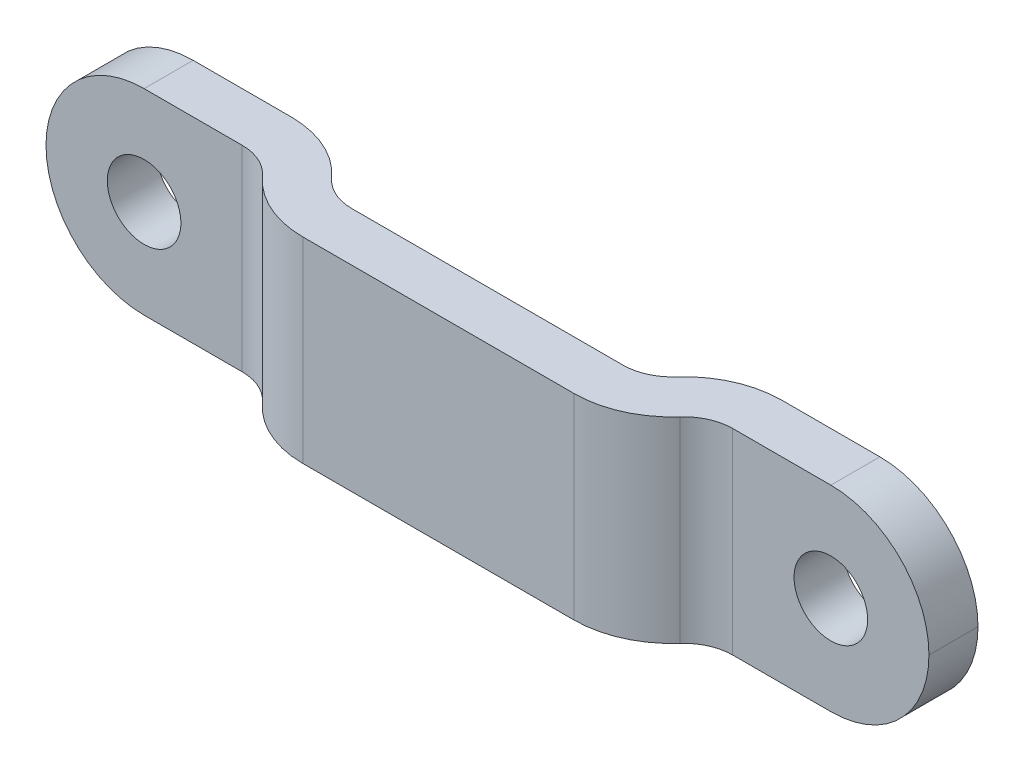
SolidWorks part; units mm, degrees
ref_plane "front" through (0, 0, 0) normal (0, 0, 1) x (1, 0, 0)
ref_plane "top" through (0, 0, 0) normal (0, 1, 0) x (1, 0, 0)
ref_plane "side" through (0, 0, 0) normal (1, 0, 0) x (0, 0, -1)
sketch "Sketch1"
  dimension "D5" = 6.35
  dimension "D3" = 6.35
  dimension "D1" = 3.175
  dimension "D2" = 57.15
  dimension "D4" = 31.75
  dimension "D7" = 3.175
extrude "Base-Extrude" add sketch "Sketch1" along normal mid plane 12.7
fillet "Fillet1" radius 6.35 8 edges at (28.575, -6.35, 1.5875) (-28.575, -6.35, 1.5875) (-28.575, 0, 0) (28.575, 0, 0) (28.575, 0, 3.175) (-28.575, 0, 3.175) (28.575, 6.35, 1.5875) (-28.575, 6.35, 1.5875)
sketch "Sketch2"
  dimension "D1" = 4.7625
extrude "Cut-Extrude1" cut sketch "Sketch2" against normal through all
